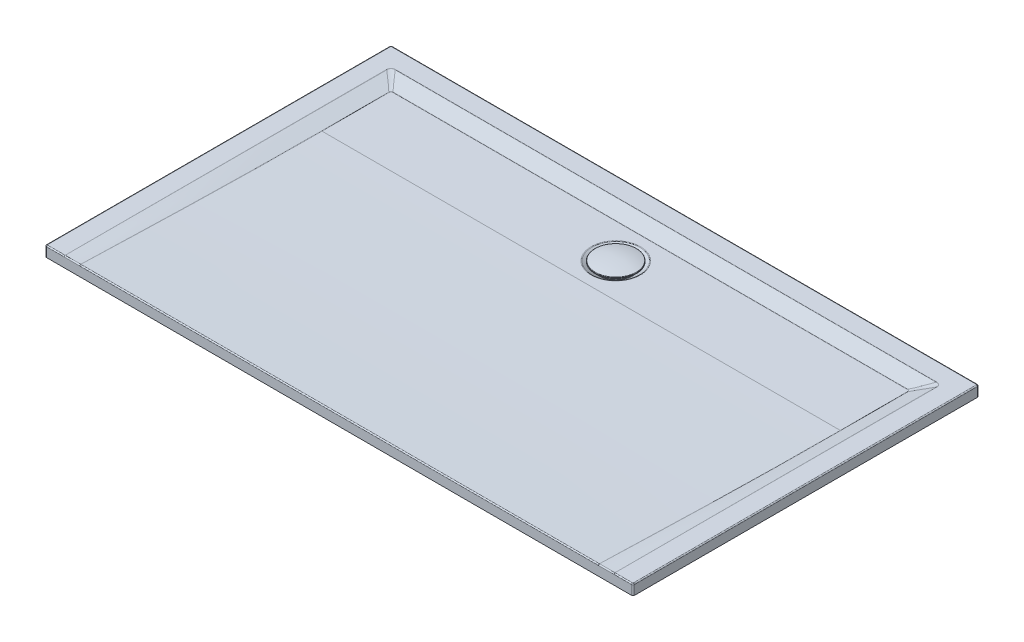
SolidWorks part; units mm, degrees
ref_plane "Płaszczyzna przednia" through (0, 0, 0) normal (0, 0, 1) x (1, 0, 0)
ref_plane "Płaszczyzna górna" through (0, 0, 0) normal (0, 1, 0) x (1, 0, 0)
ref_plane "Płaszczyzna prawa" through (0, 0, 0) normal (1, 0, 0) x (0, 0, -1)
sketch "Szkic1" plane through (0, 0, 0) normal (0, 1, 0) x (1, 0, 0)
  line L0 (0, 500) -> (0, -500) construction
  line L1 (-850, 500) -> (850, 500)
  line L2 (-850, 500) -> (-850, -500)
  line L3 (-850, -500) -> (850, -500)
  line L4 (850, 500) -> (850, -500)
  line L5 (-795, -500) -> (-795, 445)
  line L6 (-795, 445) -> (795, 445)
  line L7 (795, 445) -> (795, -500)
  line L8 (-750, -500) -> (-750, 400)
  line L9 (-750, 400) -> (750, 400)
  line L10 (750, 400) -> (750, -500)
  circle A0 centre (0, 300) radius 45
  circle A1 centre (0, 300) radius 70
  point P9 (0, 445)
  dimension "D6" = 90
  dimension "D7" = 140
  dimension "D1" = 1700
  dimension "D2" = 55
  dimension "D3" = 55
  dimension "D5" = 200
  dimension "D8" = 1000
  dimension "D4" = 45
sketch "Szkic2" plane through (0, 0, 0) normal (0, 1, 0) x (1, 0, 0)
  line L0 (-850, -500) -> (850, -500) construction
  line L1 (850, 500) -> (850, -500) construction
  line L2 (795, 445) -> (795, -500) construction
  line L3 (-795, 445) -> (795, 445) construction
  line L4 (-850, 500) -> (850, 500) construction
  line L5 (-795, -500) -> (-795, 445) construction
  line L6 (-850, 500) -> (-850, -500) construction
  line L7 (-850, -500) -> (-795, -500)
  line L8 (850, 500) -> (850, -500)
  line L9 (795, 445) -> (795, -500)
  line L10 (-795, 445) -> (795, 445)
  line L11 (-850, 500) -> (850, 500)
  line L12 (-795, -500) -> (-795, 445)
  line L13 (-850, 500) -> (-850, -500)
  line L14 (795, -500) -> (850, -500)
surface "Powierzchnia-Płaszczyzna1" sketch "Szkic2"
ref_plane "Płaszczyzna1" through (0, -15, 0) normal (0, 1, 0) x (-1, 0, 0)
sketch "Szkic3" plane through (0, -15, 0) normal (0, 1, 0) x (-1, 0, 0)
  line L0 (750, -200) -> (-750, -200)
  line L1 (750, 500) -> (750, -400) construction
  line L2 (-750, -400) -> (-750, 500) construction
  line L3 (0, -200) -> (0, -400) construction
  line L4 (750, -400) -> (-750, -400) construction
  line L5 (-750, -400) -> (-750, -200)
  line L6 (750, -200) -> (750, -400)
  line L7 (750, -400) -> (-750, -400)
  circle A0 centre (0, -300) radius 70 construction
  circle A1 centre (0, -300) radius 70
  point P10 (0, -300)
surface "Powierzchnia-Płaszczyzna2" sketch "Szkic3"
sketch "Szkic4" plane through (0, 0, 0) normal (0, 1, 0) x (1, 0, 0)
  line L0 (750, -500) -> (-750, -500)
other "Granica-Powierzchnia1"
other "Granica-Powierzchnia2"
other "Granica-Powierzchnia3"
mirror "Lustro1" about plane through (0, 0, 0) normal (1, 0, 0)
sketch "Szkic5" plane through (0, 0, 0) normal (0, 1, 0) x (1, 0, 0)
  line L0 (850, 500) -> (850, -500) construction
  line L1 (-850, 500) -> (850, 500) construction
  line L2 (-850, 500) -> (-850, -500) construction
  line L3 (-850, -500) -> (850, -500) construction
  line L4 (850, 500) -> (850, -500)
  line L5 (-850, 500) -> (850, 500)
  line L6 (-850, 500) -> (-850, -500)
  line L7 (-850, -500) -> (850, -500)
surface "Powierzchnia-Wyciągnięcie1" sketch "Szkic5" parameters "D1"=30
sketch "Szkic7" plane through (0, 0, 0) normal (1, 0, 0) x (0, 0, -1)
  line L0 (300, 0) -> (300, -30) construction
  line L1 (500, -30) -> (-500, -30) construction
  line L2 (345, -30) -> (345, -28)
  line L3 (345, -28) -> (349, -28)
  line L6 (349, -28) -> (370, -15)
  dimension "D1" = 90
  dimension "D2" = 2
  dimension "D3" = 98
surface "Powierzchnia-Obrót wokół linii środkowej1" sketch "Szkic7" parameters "D1"=360
surface "Powierzchnia-Płaszczyzna3"
surface "Powierzchnia-Połącz1"
fillet "Zaokrąglenie1" radius 4 6 edges at (0, -28, -349) (0, -15, -230) (850, -15, 500) (850, -15, -500) (-850, -15, -500) (-850, -15, 500)
fillet "Zmienne zaokrąglenie1" radius 40 2 edges at (772.5, -7.5, -422.5)
fillet "Zaokrąglenie3" radius 3 12 edges
fillet "Zaokrąglenie4" radius 3 12 edges at (-848.8284, 0, -498.8284) (0, 0, -500) (848.8284, 0, -498.8284) (850, 0, 0) (848.8284, 0, 498.8284) (820.5, 0, 500) (-820.5, 0, 500) (-848.8284, 0, 498.8284) (-850, 0, 0)
sketch "Szkic8" plane through (0, 0, 0) normal (1, 0, 0) x (0, 0, -1)
  line L0 (300, 0) -> (300, -30) construction
  line L1 (300, -5.6601) -> (179.8469, -5.6601) construction
  line L2 (360, -14.7573) -> (360, -17)
  line L3 (360, -17) -> (300, -17)
  line L4 (300, -17) -> (300, -5.6601)
  line L5 (300, -5.6601) -> (199.9922, 95.6514)
  arc A0 (300, -5.6601) -> (359.2694, -13.7943) centre (300, -225.6601) cw
  arc A1 (359.2694, -13.7943) -> (360, -14.7573) centre (359, -14.7573) cw
  point P11 (360, -14)
  dimension "D1" = 220
  dimension "D4" = 1
  dimension "D2" = 60
  dimension "D3" = 3
  dimension "D5" = 13
revolve "Obrót wokół linii środkowej1" add sketch "Szkic8" angle 360 about L4
